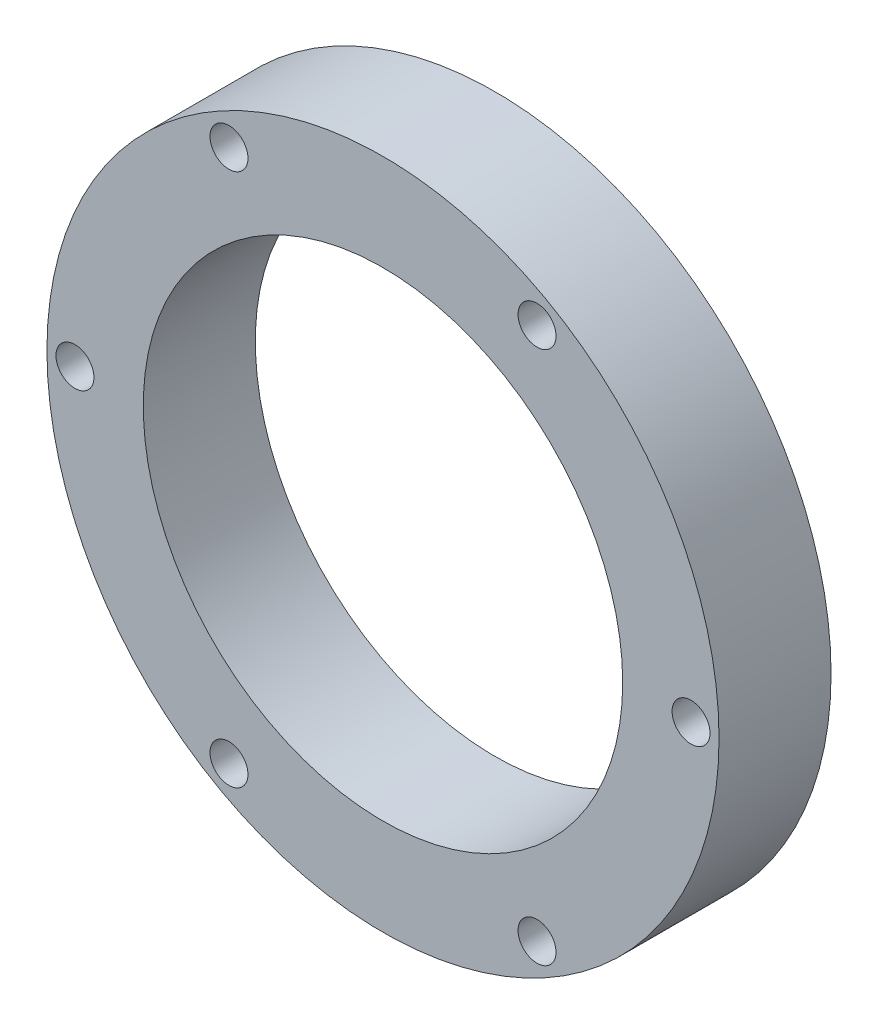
SolidWorks part; units mm, degrees
ref_plane "Front" through (0, 0, 0) normal (0, 0, 1) x (1, 0, 0)
ref_plane "Top" through (0, 0, 0) normal (0, 1, 0) x (1, 0, 0)
ref_plane "Right" through (0, 0, 0) normal (1, 0, 0) x (0, 0, -1)
sketch "Sketch1" plane through (0, 0, 0) normal (0, 0, 1) x (1, 0, 0)
  circle A0 centre (0, 0) radius 38.1
  circle A1 centre (0, 0) radius 27.178
  dimension "D1" = 54.356
  dimension "D2" = 76.2
extrude "Boss-Extrude1" add sketch "Sketch1" along normal blind 12.7
hole_wizard "#18 (0.1695) Diameter Hole1" positions "Sketch2" profile "Sketch4" hole size "#18" standard "ANSI Inch"
sketch "Sketch2" plane through (0, 0, 12.7) normal (0, 0, 1) x (1, 0, 0)
  circle A0 centre (0, 0) radius 38.1 construction
  point P0 (-34.925, 0)
  point P11 (-17.4625, 30.2459)
  point P12 (17.4625, 30.2459)
  point P13 (34.925, 0)
  point P14 (17.4625, -30.2459)
  point P15 (-17.4625, -30.2459)
  dimension "D1" = 34.925
  dimension "D2" = 6
sketch "Sketch4" plane through (-34.925, 0, 12.7) normal (1, 0, 0) x (0, -1, 0)
  line L0 (0, 0) -> (0, 12.7)
  line L1 (0, 12.7) -> (2.1526, 12.7)
  line L2 (2.1526, 12.7) -> (2.1526, 0)
  line L5 (2.1526, 0) -> (0, 0)
  line L11 (0, -6.35) -> (0, 107.95) construction
  dimension "Thru Hole Dia." = 4.3053
  dimension "Thru Hole Depth" = 12.7
sketch "Sketch5" plane through (0, 0, 0) normal (0, 0, -1) x (-1, 0, 0)
  circle A0 centre (0, 0) radius 29.1592
  circle A1 centre (0, 0) radius 31.8008
  dimension "D1" = 2.6416
  dimension "D2" = 63.6016
extrude "Cut-Extrude1" cut sketch "Sketch5" against normal blind 1.3208
sketch "Sketch6" [suppressed] plane through (0, 0, 12.7) normal (0, 0, 1) x (1, 0, 0)
  circle A0 centre (0, 0) radius 29.083
  circle A1 centre (0, 0) radius 27.178 construction
  circle A2 centre (0, 0) radius 31.623
  dimension "D1" = 1.905
  dimension "D2" = 2.54
sketch "Sketch7" [suppressed] plane through (0, 0, 0) normal (0, 0, -1) x (-1, 0, 0)
  circle A0 centre (0, 0) radius 27.4955
  circle A1 centre (0, 0) radius 31.0261
  dimension "D1" = 62.0522
  dimension "D2" = 3.5306
sketch "Sketch8" plane through (0, 0, 12.7) normal (0, 0, 1) x (1, 0, 0)
  circle A0 centre (0, 0) radius 32.004
  dimension "D1" = 64.008
extrude "3D Print Mod for 3/4\" Tubing" [suppressed] cut sketch "Sketch8" against normal through all
